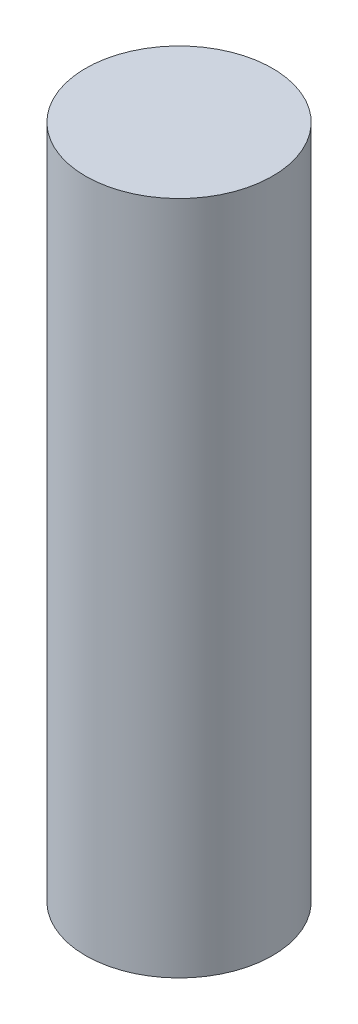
SolidWorks part; units mm, degrees
ref_plane "Front Plane" through (0, 0, 0) normal (0, 0, 1) x (1, 0, 0)
ref_plane "Top Plane" through (0, 0, 0) normal (0, 1, 0) x (1, 0, 0)
ref_plane "Right Plane" through (0, 0, 0) normal (1, 0, 0) x (0, 0, -1)
sketch "Sketch1" plane through (0, 0, 0) normal (0, 1, 0) x (1, 0, 0)
  circle A0 centre (0, 0) radius 9
  dimension "D1" = 18
extrude "Boss-Extrude1" add sketch "Sketch1" along normal mid plane 65
